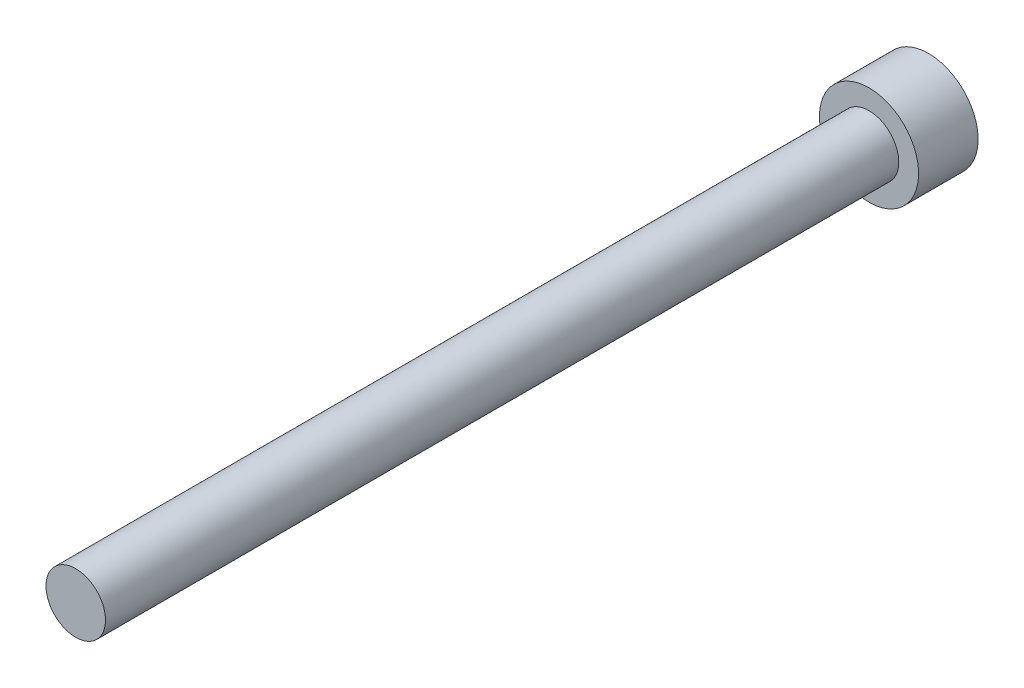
SolidWorks part; units mm, degrees
ref_plane "Front Plane" through (0, 0, 0) normal (0, 0, 1) x (1, 0, 0)
ref_plane "Top Plane" through (0, 0, 0) normal (0, 1, 0) x (1, 0, 0)
ref_plane "Right Plane" through (0, 0, 0) normal (1, 0, 0) x (0, 0, -1)
ref_plane "Plane1" through (0, 0, 0) normal (0, -1, 0) x (1, 0, 0)
sketch "Sketch1" plane through (0, 0, 0) normal (0, -1, 0) x (1, 0, 0)
  line L0 (1.5, 43) -> (0, 43)
  line L1 (0, 43) -> (0, 0)
  line L2 (0, 0) -> (2.5, 0)
  line L3 (2.5, 0) -> (2.5, 3)
  line L4 (2.5, 3) -> (1.5, 3)
  line L5 (1.5, 3) -> (1.5, 43)
  line L6 (0, 43.0005) -> (0, -0.0009) construction
revolve "Revolve1" add sketch "Sketch1" angle 360 about L6
